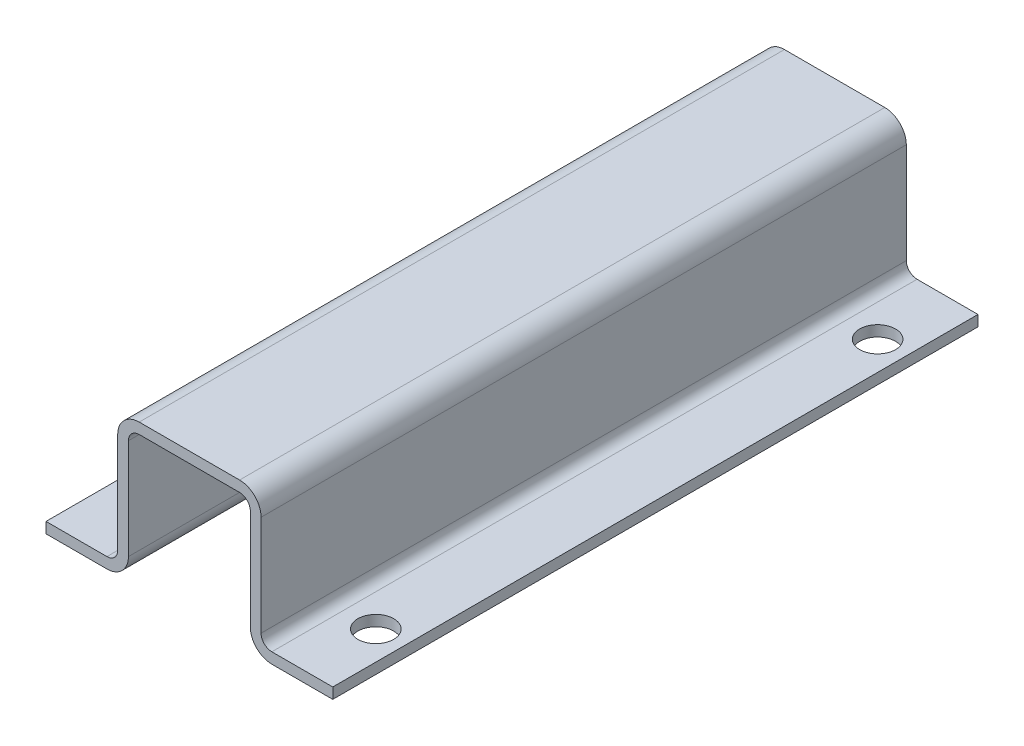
SolidWorks part; units mm, degrees
ref_plane "Plan de face" through (0, 0, 0) normal (0, 0, 1) x (1, 0, 0)
ref_plane "Plan de dessus" through (0, 0, 0) normal (0, 1, 0) x (1, 0, 0)
ref_plane "Plan de droite" through (0, 0, 0) normal (1, 0, 0) x (0, 0, -1)
sketch "Esquisse1" plane through (0, 0, 0) normal (0, 0, 1) x (1, 0, 0)
  line L0 (-20, 0) -> (-11.5, 0)
  line L1 (-10, 1.5) -> (-10, 15.5)
  line L2 (-7, 18.5) -> (7, 18.5)
  line L3 (10, 15.5) -> (10, 1.5)
  line L4 (11.5, 0) -> (20, 0)
  arc A0 (-7, 18.5) -> (-10, 15.5) centre (-7, 15.5) ccw
  arc A1 (10, 15.5) -> (7, 18.5) centre (7, 15.5) ccw
  arc A2 (-10, 1.5) -> (-11.5, 0) centre (-11.5, 1.5) cw
  arc A3 (10, 1.5) -> (11.5, 0) centre (11.5, 1.5) ccw
  dimension "D1" = 3
  dimension "D2" = 1.5
  dimension "D3" = 20
  dimension "D4" = 10
  dimension "D5" = 18.5
  dimension "D6" = 40
  dimension "D7" = 20
extrude "Extru.-Mince1" add sketch "Esquisse1" along normal mid plane 90 thin
sketch "Esquisse2" plane through (0, 0, 0) normal (0, 1, 0) x (-1, 0, 0)
  line L0 (-11.5, 45) -> (-20, 45) construction
  circle A0 centre (-16, 35) radius 2.5
  circle A1 centre (16, 35) radius 2.5
  circle A2 centre (16, -35) radius 2.5
  circle A3 centre (-16, -35) radius 2.5
  dimension "D5" = 5
  dimension "D1" = 32
  dimension "D2" = 16
  dimension "D3" = 70
  dimension "D4" = 10
extrude "Enlèv. mat.-Extru.1" cut sketch "Esquisse2" against normal blind 90
